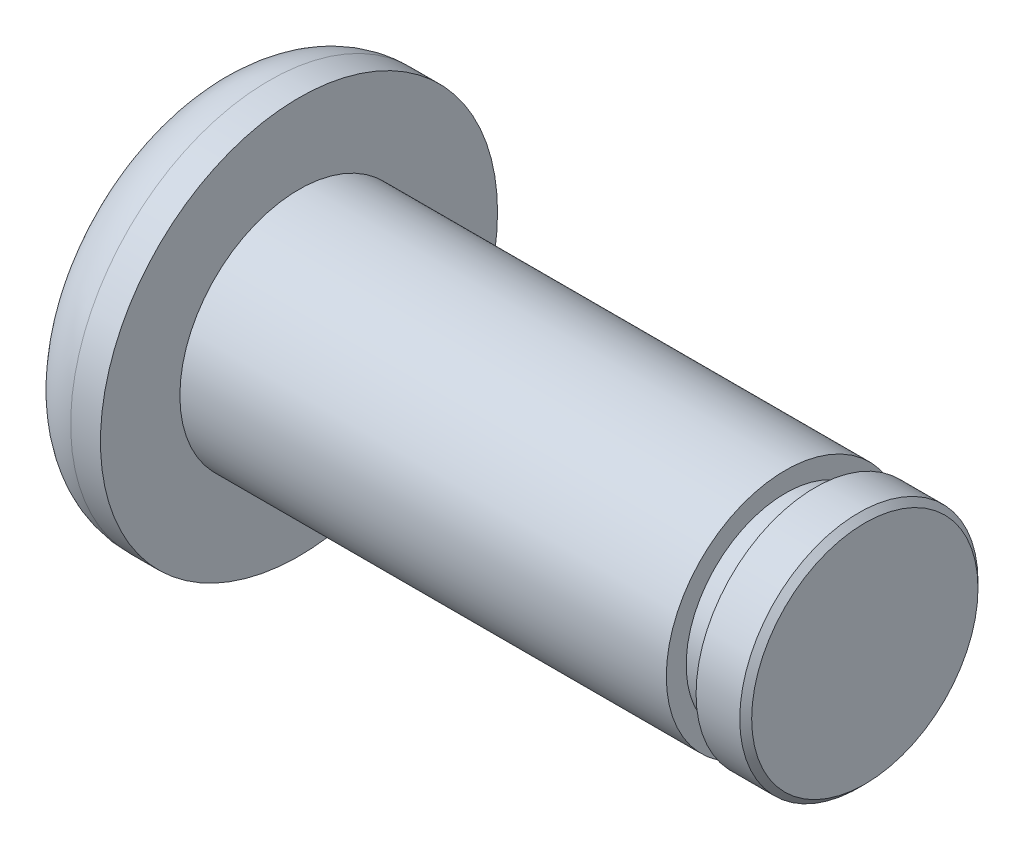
SolidWorks part; units mm, degrees
ref_plane "Plan de face" through (0, 0, 0) normal (0, 0, 1) x (1, 0, 0)
ref_plane "Plan de dessus" through (0, 0, 0) normal (0, 1, 0) x (1, 0, 0)
ref_plane "Plan de droite" through (0, 0, 0) normal (1, 0, 0) x (0, 0, -1)
sketch "Esquisse1" plane through (0, 0, 0) normal (0, 0, 1) x (1, 0, 0)
  line L0 (0, 0) -> (54.3256, 0) construction
  line L1 (28.5, 0) -> (28.5, 6)
  line L2 (28.5, 6) -> (26, 6)
  line L3 (26, 6) -> (26, 5)
  line L4 (26, 5) -> (24.5, 5)
  line L5 (24.5, 5) -> (24.5, 6)
  line L6 (24.5, 6) -> (0, 6)
  line L7 (0, 6) -> (0, 10)
  line L8 (0, 10) -> (-1.5, 10)
  line L9 (-4.5, 7) -> (-4.5, 0)
  line L10 (0, 0) -> (-15.6309, 0) construction
  line L11 (28.5, 0) -> (-4.5, 0)
  arc A0 (-1.5, 10) -> (-4.5, 7) centre (-1.5, 7) ccw
  point P16 (-4.5, 10)
  dimension "D4" = 3
  dimension "D1" = 20
  dimension "D2" = 12
  dimension "D3" = 4.5
  dimension "D5" = 2.5
  dimension "D6" = 10
  dimension "D7" = 1.5
  dimension "D8" = 33
revolve "Révolution1" add sketch "Esquisse1" angle 360 about L10
chamfer "Chanfrein1" distance 0.3 angle 45 1 edges at (28.5, 0, -6)
